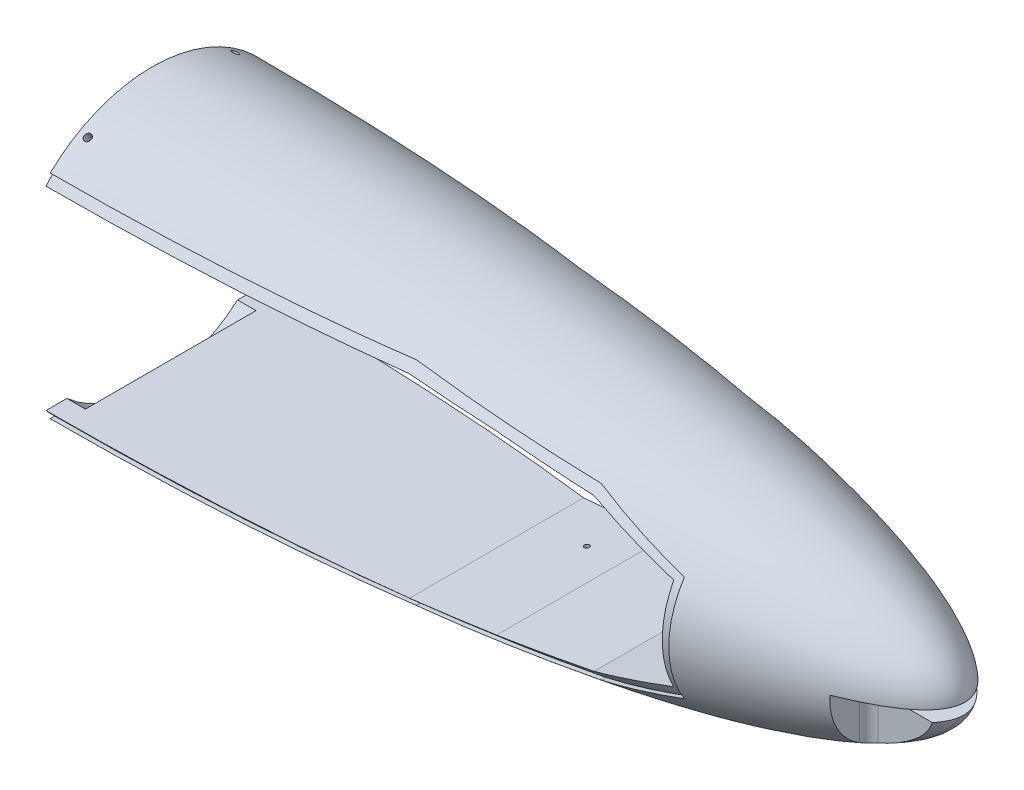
SolidWorks part; units mm, degrees
ref_plane "Plane1" through (0, 0, 0) normal (0, 0, 1) x (1, 0, 0)
ref_plane "Plane2" through (0, 0, 0) normal (0, 1, 0) x (1, 0, 0)
ref_plane "Plane3" through (0, 0, 0) normal (1, 0, 0) x (0, 0, -1)
sketch "Sketch1" plane through (0, 0, 0) normal (0, 0, 1) x (1, 0, 0)
  line L0 (0, 0) -> (558.8, 0) construction
  line L1 (558.8, 0) -> (0, 0)
  line L2 (0, 0) -> (0, 101.346)
  line L3 (0, 0) -> (558.8, 0) construction
  ellipse E0 centre (0, 0) end of major axis (558.8, 0) minor radius 101.346 (558.8, 0) -> (0, 101.346) ccw
  dimension "D1" = 558.8
  dimension "D2" = 101.346
revolve "Base-Revolve" add sketch "Sketch1" angle 180 about L0
sketch "Sketch2" plane through (0, 0, 0) normal (0, 0, 1) x (1, 0, 0)
  line L0 (415.29, 0) -> (0, 0) construction
  line L1 (0, 66.802) -> (236.728, 66.802)
  line L2 (236.728, 66.802) -> (294.64, 60.706)
  line L3 (294.64, 60.706) -> (358.14, 52.324)
  line L4 (358.14, 52.324) -> (415.29, 31.75)
  line L5 (415.29, 31.75) -> (415.29, -31.75)
  line L6 (0, -66.802) -> (0, 66.802)
  line L7 (358.14, -52.324) -> (415.29, -31.75)
  line L8 (294.64, -60.706) -> (358.14, -52.324)
  line L9 (236.728, -66.802) -> (294.64, -60.706)
  line L10 (0, -66.802) -> (236.728, -66.802)
  dimension "D1" = 236.728
  dimension "D2" = 57.912
  dimension "D3" = 63.5
  dimension "D4" = 57.15
  dimension "D5" = 66.802
  dimension "D6" = 60.706
  dimension "D7" = 52.324
  dimension "D8" = 31.75
  dimension "D9" = 415.29
extrude "Cut-Extrude2" cut sketch "Sketch2" against normal through all and the other way through all
sketch "Sketch3" plane through (0, 0, 0) normal (-1, 0, 0) x (0, 0, 1)
  line L0 (-101.346, 0) -> (-98.806, 0)
  arc A0 (76.2135, 66.802) -> (-76.2135, 66.802) centre (0, 0) ccw construction
  point P0 (0, 101.346)
  point P1 (101.346, 0)
  point P5 (-101.346, 0)
sketch "Sketch5" plane through (0, 0, 0) normal (-1, 0, 0) x (0, 0, 1)
  circle A0 centre (0, 0) radius 88.9
  dimension "D1" = 177.8
extrude "Cut-Extrude3" cut sketch "Sketch5" against normal blind 12.7
ref_plane "hole_off_plane" through (6.35, 0, 0) normal (-1, 0, 0) x (0, 0, 1)
ref_plane "perp_hole_plane" through (0, 0, 0) normal (0, 0.866, 0.5) x (-1, 0, 0)
sketch "Sketch9" plane through (0, 0, 0) normal (0, 0.866, 0.5) x (-1, 0, 0)
  line L0 (-6.35, -76.2135) -> (-6.35, 76.2135) construction
  circle A0 centre (-6.35, 0) radius 2.4257
  dimension "D1" = 4.8514
  dimension "D2" = 6.35
extrude "Cut-Extrude6" cut sketch "Sketch9" along normal through all
pattern_circular "CirPattern5" count 2 every 60 about axis through (0, 0, 0) along (1, 0, 0) of "Cut-Extrude6"
pattern_circular "CirPattern6" count 2 every 120 about axis through (0, 0, 0) along (1, 0, 0) of "Cut-Extrude6"
pattern_circular "CirPattern7" count 2 every 180 about axis through (6.35, 0, 0) along (0, -0.866, -0.5) of "Cut-Extrude6"
sketch "Sketch10" plane through (0, 0, 0) normal (0, 0, 1) x (1, 0, 0)
  line L0 (558.8181, 2.286) -> (558.8181, 0)
  line L1 (558.8181, 0) -> (558.8181, -5.715)
  line L2 (558.8181, -5.715) -> (508.0181, -5.715)
  line L3 (508.0181, -5.715) -> (508.0181, 2.286)
  line L5 (12.7, 0) -> (0, 0) construction
  line L6 (558.8181, 2.286) -> (508.0181, 2.286)
  line L8 (558.8181, 0) -> (500.7158, 0) construction
  point P9 (508.0181, 0)
  dimension "D1" = 2.286
  dimension "D2" = 50.8
  dimension "D3" = 5.715
extrude "tail_slot" cut sketch "Sketch10" against normal through all and the other way through all
sketch "Sketch11" plane through (0, 0, 0) normal (0, 1, 0) x (1, 0, 0)
  line L0 (558.8, -15.24) -> (514.35, -15.24)
  line L1 (508, -21.59) -> (508, -48.26)
  line L2 (508, -48.26) -> (558.8, -48.26)
  line L3 (558.8, -48.26) -> (558.8, -15.24)
  line L4 (0, 0) -> (558.8, 0) construction
  line L5 (12.7, 0) -> (0, 0) construction
  arc A0 (514.35, -15.24) -> (508, -21.59) centre (514.35, -21.59) ccw
  circle A1 centre (541.02, 0) radius 1.7272
  circle A2 centre (525.7846, 0) radius 1.7272
  dimension "D4" = 6.35
  dimension "D5" = 3.4544
  dimension "D6" = 17.78
  dimension "D7" = 15.2354
  dimension "D1" = 50.8
  dimension "D2" = 33.02
  dimension "D3" = 15.24
extrude "Cut-Extrude8" cut sketch "Sketch11" against normal blind 76.2
ref_plane "Plane4" through (262.128, 0, 0) normal (-1, 0, 0) x (0, 0, 1)
sketch "Sketch12" plane through (262.128, 0, 0) normal (-1, 0, 0) x (0, 0, 1)
  circle A0 centre (0, 0) radius 89.5096
sketch "Sketch15" plane through (9.549, -90.7156, 0) normal (-0.1047, 0.9945, 0) x (-0.9945, -0.1047, 0)
  circle A0 centre (-262.128, -28.575) radius 1.7272
extrude "Cut-Extrude10" cut sketch "Sketch15" against normal through all
sketch "Sketch17" plane through (415.29, 0, 0) normal (-1, 0, 0) x (0, 0, 1)
  circle A1 centre (-13.208, 0) radius 2.413
  circle A2 centre (32.512, 0) radius 2.413
  dimension "D1" = 13.208
  dimension "D2" = 32.512
extrude "ADP Mount holes" cut sketch "Sketch17" against normal blind 19.05
ref_plane "Plane5" through (0, 0, 101.6) normal (0, 0, 1) x (1, 0, 0)
sketch "Sketch18" plane through (0, 0, 101.6) normal (0, 0, 1) x (1, 0, 0)
  line L0 (0, -73.152) -> (0, -66.802)
  line L3 (0, 66.802) -> (236.728, 66.802)
  line L4 (236.728, 66.802) -> (294.64, 60.706)
  line L5 (294.64, 60.706) -> (358.14, 52.324)
  line L6 (358.14, 52.324) -> (415.29, 31.75)
  line L7 (415.29, -31.75) -> (415.29, 31.75)
  line L9 (421.64, 36.2129) -> (360.2909, 58.2986)
  line L10 (0, 66.802) -> (0, 73.152)
  line L11 (237.3927, 73.1171) -> (358.971, 58.6194)
  line L12 (421.64, -36.2129) -> (421.64, 36.2129)
  line L15 (358.971, 58.6194) -> (360.2909, 58.2986)
  line L17 (236.728, 73.152) -> (237.3927, 73.1171)
  line L18 (236.728, 73.152) -> (0, 73.152)
  line L22 (236.728, -73.152) -> (0, -73.152)
  line L23 (236.728, -73.152) -> (237.3927, -73.1171)
  line L25 (358.971, -58.6194) -> (360.2909, -58.2986)
  line L28 (237.3927, -73.1171) -> (358.971, -58.6194)
  line L30 (421.64, -36.2129) -> (360.2909, -58.2986)
  line L31 (358.14, -52.324) -> (415.29, -31.75)
  line L32 (294.64, -60.706) -> (358.14, -52.324)
  line L33 (236.728, -66.802) -> (294.64, -60.706)
  line L34 (0, -66.802) -> (236.728, -66.802)
  point P38 (421.64, 0)
  point P39 (415.29, 0)
extrude "Cut-Extrude15" cut sketch "Sketch18" against normal offset from surface (28.5615 mm away) 3.175
mirror "Mirror1" about plane through (0, 0, 0) normal (0, 0, 1) of "Cut-Extrude15"
